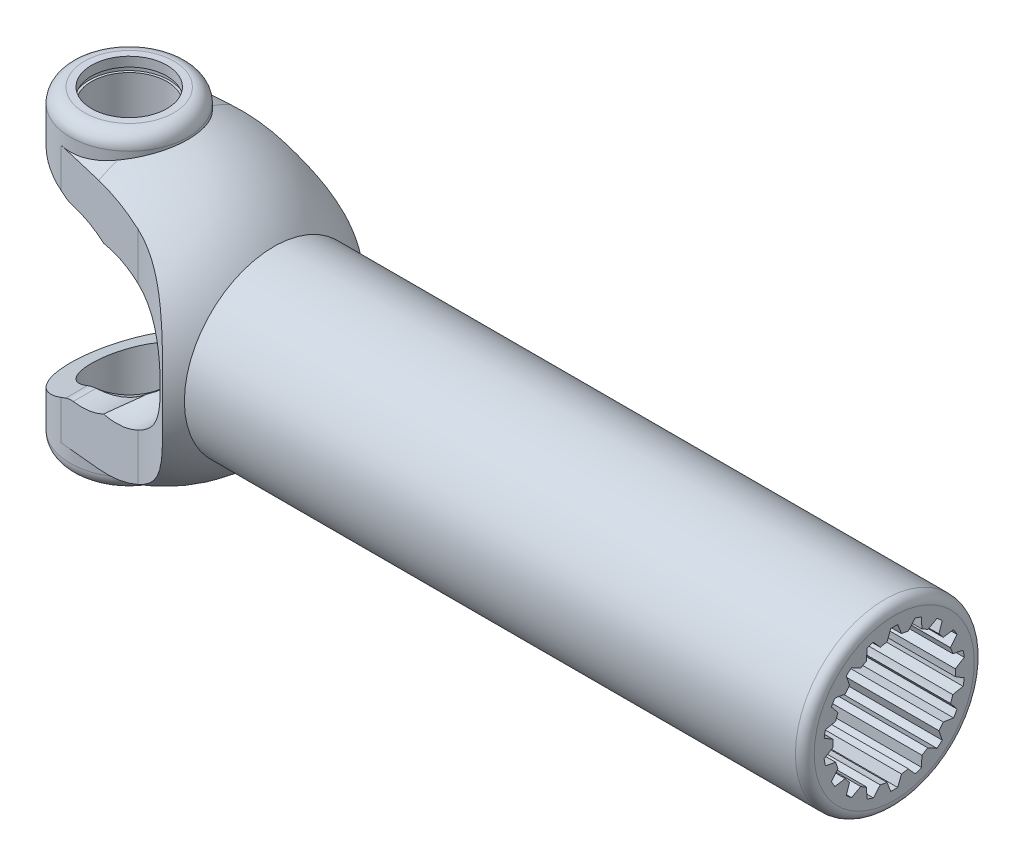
SolidWorks part; units mm, degrees
ref_plane "Front Plane" through (0, 0, 0) normal (0, 0, 1) x (1, 0, 0)
ref_plane "Top Plane" through (0, 0, 0) normal (0, 1, 0) x (1, 0, 0)
ref_plane "Right Plane" through (0, 0, 0) normal (1, 0, 0) x (0, 0, -1)
sketch "Sketch1" plane through (0, 0, 0) normal (0, 0, 1) x (1, 0, 0)
  line L0 (-12.5, 0) -> (162.5, 0)
  line L1 (162.5, 0) -> (162.5, 19)
  line L3 (7.5, 30) -> (-12.5, 30)
  line L4 (-12.5, 30) -> (-12.5, 0)
  line L6 (30.7164, 19) -> (162.5, 19)
  arc A0 (30.7164, 19) -> (7.5, 30) centre (7.5, 0) ccw
  dimension "D3" = 30
  dimension "D1" = 19
  dimension "D2" = 30
  dimension "D5" = 12.5
  dimension "D6" = 20
  dimension "D8" = 175
revolve "Revolve1" add sketch "Sketch1" angle 360 about L0
sketch "Sketch2" plane through (0, 0, 0) normal (0, 1, 0) x (1, 0, 0)
  line L0 (28.5, -21.4243) -> (28.5, -41.4243)
  line L1 (28.5, -21.4243) -> (25.0936, -24.7633) construction
  line L2 (28.5, -21.4243) -> (29.6509, -22.5985) construction
  line L3 (-12.5, 0) -> (41.0657, 0) construction
  line L4 (-12.5, 30) -> (-12.5, -30) construction
  line L5 (-2.1199, -12.3189) -> (17.609, -15.714)
  line L6 (-2.1199, 12.3189) -> (17.609, 15.714)
  line L7 (28.5, -41.4243) -> (-41.5, -41.4243)
  line L8 (-41.5, -41.4243) -> (-41.5, 41.4243)
  line L9 (-41.5, 41.4243) -> (28.5, 41.4243)
  line L10 (28.5, 41.4243) -> (28.5, 21.4243)
  arc A0 (-2.1199, 12.3189) -> (-2.1199, -12.3189) centre (0, 0) ccw
  arc A2 (17.609, -15.714) -> (28.5, -21.4243) centre (14.2171, -35.4243) cw
  arc A3 (7.5, -30) -> (30.7164, -19) centre (7.5, 0) ccw construction
  arc A4 (7.5, -30) -> (30.7164, -19) centre (7.5, 0) ccw construction
  arc A5 (7.5, -30) -> (30.7164, -19) centre (7.5, 0) ccw construction
  arc A6 (17.609, 15.714) -> (28.5, 21.4243) centre (14.2171, 35.4243) ccw
  dimension "D1" = 25
  dimension "D2" = 20
  dimension "D3" = 20
  dimension "D4" = 70
  dimension "D5" = 41
extrude "Cut-Extrude1" cut sketch "Sketch2" against normal through all both and the other way through all
sketch "Sketch3" plane through (0, 0, 0) normal (0, 0, 1) x (1, 0, 0)
  line L0 (-12.5, 24) -> (0, 18)
  line L1 (-12.5, 30) -> (-12.5, -30) construction
  line L4 (0, 18) -> (0, -18)
  line L5 (24, 0) -> (0, 0) construction
  line L7 (-12.5, -24) -> (0, -18)
  line L9 (-12.5, 24) -> (-12.5, -24)
  dimension "D1" = 12.5
  dimension "D3" = 6
  dimension "D4" = 12
extrude "Cut-Extrude2" cut sketch "Sketch3" against normal through all both and the other way through all
sketch "Sketch7" plane through (0, 0, 0) normal (1, 0, 0) x (0, 0, -1)
  line L0 (0, 0) -> (0, 43.6765) construction
  line L1 (-20, 18) -> (-8, 18)
  line L2 (12.6837, 18) -> (-12.6837, 18) construction
  line L5 (20, 18) -> (8, 18)
  line L6 (-20, 18) -> (-20, 0)
  line L8 (-20, 0) -> (20, 0)
  line L9 (20, 0) -> (20, 18)
  arc A0 (8, 18) -> (-8, 18) centre (0, 0) ccw
  dimension "D1" = 16
  dimension "D3" = 40
revolve "Cut-Revolve2" cut sketch "Sketch7" angle 360 about L8
fillet "Fillet1" radius 5 4 edges at (0, -18, 10.3419) (0, -18, -10.3419) (0, 18, -10.3419) (0, 18, 10.3419)
sketch "Sketch4" plane through (0, 0, 0) normal (0, 0, 1) x (1, 0, 0)
  line L0 (-9.5, 33) -> (0, 33)
  line L1 (0, 33) -> (0, 24)
  line L2 (0, 24) -> (-12.5, 24)
  line L3 (-12.5, 30) -> (-12.5, 24) construction
  line L4 (-12.5, 24) -> (-12.5, 30)
  line L5 (7.5, 30) -> (-12.5, 30) construction
  arc A0 (-12.5, 30) -> (-9.5, 33) centre (-9.5, 30) cw
  dimension "D1" = 3
revolve "Revolve2" add sketch "Sketch4" angle 360 about L1
mirror "Mirror1" about plane through (0, 0, 0) normal (0, 1, 0) of "Revolve2"
sketch "Sketch5" plane through (0, 33, 0) normal (0, 1, 0) x (1, 0, 0)
  circle A0 centre (0, 0) radius 8
  dimension "D1" = 16
extrude "Cut-Extrude3" cut sketch "Sketch5" against normal through all
sketch "Sketch6" plane through (0, 0, 0) normal (0, 0, 1) x (1, 0, 0)
  line L0 (8, 31) -> (8.5, 31)
  line L1 (8.5, 31) -> (8.5, 30)
  line L2 (8.5, 30) -> (8, 30)
  line L3 (8, 30) -> (8, 31)
  line L4 (0, 0) -> (0, 47.1154) construction
  line L5 (9.5, 33) -> (-9.5, 33) construction
  line L7 (0, 0) -> (51.1336, 0) construction
  line L8 (8, -30) -> (8, -31)
  line L9 (8.5, -30) -> (8, -30)
  line L10 (8.5, -31) -> (8.5, -30)
  line L11 (8, -31) -> (8.5, -31)
  dimension "D1" = 8
  dimension "D2" = 2
  dimension "D3" = 1
  dimension "D4" = 0.5
revolve "Cut-Revolve1" cut sketch "Sketch6" angle 360 about L4
sketch "Sketch8" plane through (0, 0, 0) normal (0, 1, 0) x (1, 0, 0)
  line L0 (19.374, 3.5567) -> (6.3836, 11.0567)
  line L1 (-11.0329, -19.1096) -> (22.7452, 39.3958) construction
  line L4 (6.3836, 11.0567) -> (14.5636, 25.2249)
  line L5 (14.5636, 25.2249) -> (25.5, 18.9107)
  line L6 (0, 0) -> (0, 51.0803) construction
  line L7 (18, 15.7853) -> (18, 8)
  line L8 (18, 15.7853) -> (18, 8) construction
  arc A0 (19.374, 3.5567) -> (25.5, 18.9107) centre (5.5215, 17.9827) ccw
  arc A1 (18, 15.7853) -> (28.5, 21.4243) centre (14.2171, 35.4243) ccw
  arc A2 (18, 15.7853) -> (28.5, 21.4243) centre (14.2171, 35.4243) ccw construction
  arc A3 (18, -8) -> (18, 8) centre (0, 0) ccw
  arc A4 (18, -8) -> (18, 8) centre (0, 0) ccw construction
  point P15 (25.5, 18.9107)
  dimension "D1" = 15
  dimension "D4" = 3
  dimension "D2" = 30
  dimension "D3" = 20
revolve "Cut-Revolve3" cut sketch "Sketch8" angle 360 about L1
mirror "Mirror2" about plane through (0, 0, 0) normal (0, 0, 1) of "Cut-Revolve3"
sketch "Sketch9" plane through (162.5, 0, 0) normal (1, 0, 0) x (0, 0, -1)
  line L0 (0, 0) -> (0, 15) construction
  line L1 (0, 0) -> (2.2574, 12.8025) construction
  line L2 (0.7327, 14.9821) -> (1.5393, 12.9086)
  line L3 (0, 0) -> (1.5393, 12.9086) construction
  line L4 (-0.7327, 14.9821) -> (-1.5393, 12.9086)
  line L5 (0, 0) -> (0.7327, 14.9821) construction
  arc A1 (0.7327, 14.9821) -> (-0.7327, 14.9821) centre (0, 0) ccw
  arc A3 (-1.5393, 12.9086) -> (1.5393, 12.9086) centre (0, 0) ccw
  dimension "D1" = 26
  dimension "D3" = 30
  dimension "D4" = 4
  dimension "D2" = 10
  dimension "D5" = 2.8
extrude "Cut-Extrude4" cut sketch "Sketch9" against normal blind 110
pattern_circular "CirPattern1" count 18 over 360 about axis through (0, 0, 0) along (1, 0, 0) of "Cut-Extrude4"
fillet "Fillet2" radius 2 1 edges at (162.5, 0, 19)
